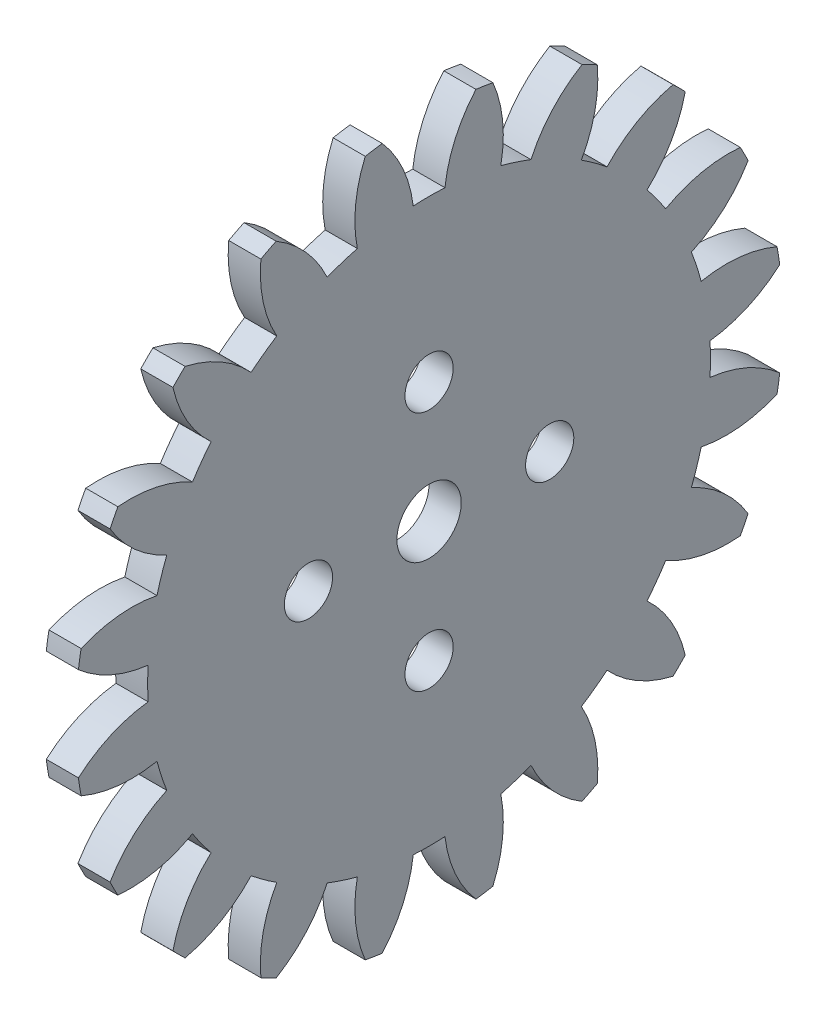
SolidWorks part; units mm, degrees
other "Bore"
ref_plane "Plan de face" through (0, 0, 0) normal (0, 0, 1) x (1, 0, 0)
ref_plane "Plan de dessus" through (0, 0, 0) normal (0, 1, 0) x (1, 0, 0)
ref_plane "Plan de droite" through (0, 0, 0) normal (1, 0, 0) x (0, 0, -1)
imported_body "Importée1"
sketch "Esquisse1" plane through (2, 0, 0) normal (1, 0, 0) x (0, 0, -1)
  circle A0 centre (0, -7.5) radius 1.5
  circle A1 centre (-7.5, 0) radius 1.5
  circle A2 centre (0, 7.5) radius 1.5
  circle A3 centre (7.5, 0) radius 1.5
  dimension "D1" = 3
extrude "Enlèv. mat.-Extru.1" cut sketch "Esquisse1" against normal through all
